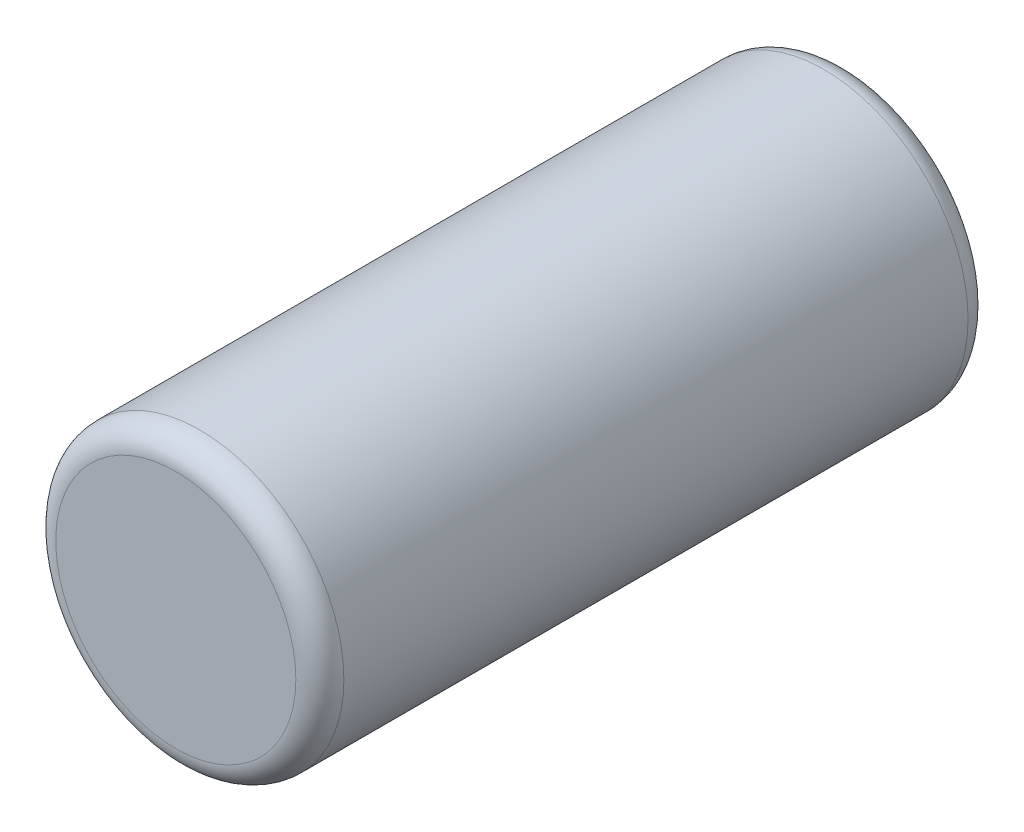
SolidWorks part; units mm, degrees
ref_plane "Face" through (0, 0, 0) normal (0, 0, 1) x (1, 0, 0)
ref_plane "Dessus" through (0, 0, 0) normal (0, 1, 0) x (1, 0, 0)
ref_plane "Droite" through (0, 0, 0) normal (1, 0, 0) x (0, 0, -1)
sketch "Esquisse1" plane through (0, 0, 0) normal (0, 0, 1) x (1, 0, 0)
  circle A0 centre (0, 0) radius 60
  dimension "D1" = 120
extrude "Base-Extrusion" add sketch "Esquisse1" along normal blind 280
fillet "Congé1" radius 10
